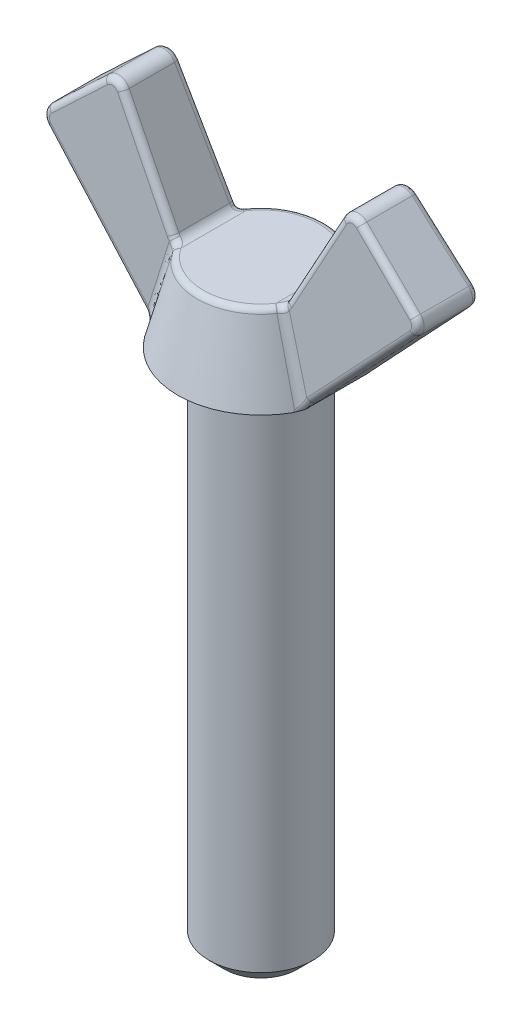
SolidWorks part; units mm, degrees
ref_plane "Front Plane" through (0, 0, 0) normal (0, 0, 1) x (1, 0, 0)
ref_plane "Top Plane" through (0, 0, 0) normal (0, 1, 0) x (1, 0, 0)
ref_plane "Right Plane" through (0, 0, 0) normal (1, 0, 0) x (0, 0, -1)
other "Configuration Table"
sketch "HeadSke" plane through (0, 0, 0) normal (0, 0, 1) x (1, 0, 0)
  line L0 (0, 0) -> (-8, 0)
  line L1 (-8, 0) -> (-6, 7.5)
  line L2 (-6, 7.5) -> (0, 7.5)
  line L3 (0, 7.5) -> (0, 0)
  line L4 (0, -38.5148) -> (0, 38.5148) construction
revolve "Head" add sketch "HeadSke" angle 360 about L4
sketch "BaseWingSke" plane through (0, 0, 0) normal (1, 0, 0) x (0, 0, -1)
  line L0 (0, 0) -> (0, 62.8635) construction
  line L1 (-2.75, 18) -> (-3.25, 0)
  line L2 (-2.75, 18) -> (2.75, 18)
  line L3 (2.75, 18) -> (3.25, 0)
  line L4 (3.25, 0) -> (-3.25, 0)
  point P8 (0, 18)
extrude "BaseWing" add sketch "BaseWingSke" along normal mid plane 36
sketch "CutWingSke" plane through (0, 0, 0) normal (0, 0, 1) x (1, 0, 0)
  line L0 (0, 0) -> (0, 84.5075) construction
  line L1 (-7.3101, 0) -> (-17.6742, 11.0212)
  line L2 (-5.1719, 7.5) -> (-10.4718, 17.3678)
  line L3 (18, 18) -> (-18, 18) construction
  line L4 (-18, 18) -> (-18, 0) construction
  line L5 (-5.1719, 7.5) -> (5.1719, 7.5)
  line L6 (-7.3101, 0) -> (7.3101, 0)
  line L7 (7.3101, 0) -> (17.6742, 11.0212)
  line L8 (5.1719, 7.5) -> (10.4718, 17.3678)
  line L9 (-7.3101, 0) -> (-18, 0) construction
  line L10 (-28, 28) -> (28, 28)
  line L11 (-28, 28) -> (-28, -10)
  line L12 (-28, -10) -> (28, -10)
  line L13 (28, 28) -> (28, -10)
  line L14 (18, 18) -> (18, 0) construction
  line L15 (-12.3511, 17.6742) -> (-17.6221, 12.7174)
  line L16 (12.3511, 17.6742) -> (17.6221, 12.7174)
  arc A0 (-10.4718, 17.3678) -> (-12.3511, 17.6742) centre (-11.529, 16.8) ccw
  arc A1 (-17.6742, 11.0212) -> (-17.6221, 12.7174) centre (-16.8, 11.8433) cw
  arc A2 (12.3511, 17.6742) -> (10.4718, 17.3678) centre (11.529, 16.8) ccw
  arc A3 (17.6742, 11.0212) -> (17.6221, 12.7174) centre (16.8, 11.8433) ccw
  point P27 (-11.2118, 18.7455)
  point P30 (-18.4963, 11.8954)
  point P33 (11.2118, 18.7455)
  point P36 (18.4963, 11.8954)
extrude "CutWing" cut sketch "CutWingSke" against normal mid plane 36
fillet "Fillet1" radius 1 6 edges at (-5.1719, 7.5, 0) (5.1719, 7.5, 0)
fillet "Fillet2" radius 0.6 38 edges at (-7.5707, 0.2772, 3.2891) (-12.7428, 5.7771, 3.0895) (-8.0054, 12.7756, 2.8951) (-5.2567, 7.7694, 3.1144) (0, 7.5, 6) (0, 7.5, -6) (5.1125, 7.6575, 3.2115) (8.0054, 12.7756, 2.8951) (7.4702, 0.1703, 3.342) (12.7428, 5.7771, 3.0895) (7.5707, 0.2772, -3.2891) (12.7428, 5.7771, -3.0895) (-7.4702, 0.1703, -3.342) (-12.7428, 5.7771, -3.0895) (-8.0054, 12.7756, -2.8951) (-5.1125, 7.6575, -3.2115) (5.2567, 7.7694, -3.1144) (8.0054, 12.7756, -2.8951) (17.9994, 11.8801, -2.92) (14.9866, 15.1958, -2.8279) (11.3359, 17.9844, -2.7504) (-17.9994, 11.8801, -2.92) (-14.9866, 15.1958, -2.8279) (-11.3359, 17.9844, -2.7504) (17.9994, 11.8801, 2.92) (14.9866, 15.1958, 2.8279) (11.3359, 17.9844, 2.7504) (-11.3359, 17.9844, 2.7504) (-14.9866, 15.1958, 2.8279) (-17.9994, 11.8801, 2.92)
sketch "BodySke" plane through (0, 0, 0) normal (0, 0, 1) x (1, 0, 0)
  line L0 (0, 0) -> (0, -98.4281) construction
  line L1 (-4.172, -22.6535) -> (-4.172, -78.0459) construction
  line L2 (0, 0) -> (-5, 0)
  line L3 (0, 0) -> (0, -50)
  line L4 (0, -50) -> (-5, -50)
  line L5 (-5, 0) -> (-5, -50)
  line L6 (9.5285, -49.25) -> (-28.2347, -49.25) construction
revolve "BaseBody" add sketch "BodySke" angle 360 about L0
sketch "ChamferedEndSke" plane through (0, 0, 0) normal (0, 0, 1) x (1, 0, 0)
  line L0 (-5, -48.5) -> (-5, -50)
  line L1 (-5, -50) -> (-3.5, -50)
  line L2 (-3.5, -50) -> (-5, -48.5)
  line L5 (0, 0) -> (0, -116.5105) construction
revolve "ChamferedEnd" cut sketch "ChamferedEndSke" angle 360 about L5
sketch "CutEndSke" plane through (0, -50, 0) normal (0, -1, 0) x (1, 0, 0)
  circle A0 centre (0, 0) radius 5 construction
  circle A1 centre (0, 0) radius 5
extrude "CutEnd" [suppressed] cut sketch "CutEndSke" against normal blind 1.5
dome "RoundedEnd" [suppressed] faces to dome 1 distance 1.5 parameters "D1"=1.5
sketch "ThdSchSke" plane through (0, 0, 0) normal (0, 0, 1) x (1, 0, 0)
  line L0 (0, 0) -> (0, -154.0819) construction
  line L1 (49.4883, -50) -> (-82.1477, -50) construction
  line L2 (5.9561, -48.247) -> (5, -48.247)
  line L3 (5, -48.247) -> (4.172, -48.725)
  line L4 (4.172, -48.725) -> (5, -49.203)
  line L5 (5, -49.203) -> (5.9561, -49.203)
  line L6 (5.9561, -49.203) -> (5.9561, -48.247)
revolve "ThreadSchematic" [suppressed] cut sketch "ThdSchSke" angle 360 about L0
pattern_linear "ThdSchPat" [suppressed] count 32 along (0, -1, 0)
equation "\"D1@CutWing\" = \"Width@BaseWing\""
equation "\"D1@Fillet1\" =\"Top_Width@HeadSke\"/12"
equation "\"D1@Fillet2\" = \"Top_Width@HeadSke\"/20"
equation "\"Thread_minor@ThreadCosmetic\" = \"Minor_dia@BodySke\""
equation "\"D1@CutEnd\" = \"Chamfer_width@ChamferedEndSke\""
equation "\"D1@RoundedEnd\" = \"Chamfer_width@ChamferedEndSke\""
equation "\"Length@ThdSchSke\" = \"Length@BodySke\""
equation "\"D1@ThdSchSke\" = \"Minor_dia@BodySke\""
equation "\"D2@ThdSchSke\" = \"Diameter@BodySke\""
equation "\"D3@ThdSchSke\" = \"Advance@BodySke\"*0.85"
equation "\"Advance@ThdSchPat\" = \"Advance@BodySke\""
equation "\"D1@ThdSchPat\" =  int( \"Length@BodySke\" / \"Advance@BodySke\" ) -1"
equation "\"Radius@CutWingSke\" = \"Height@BaseWingSke\"/15"
